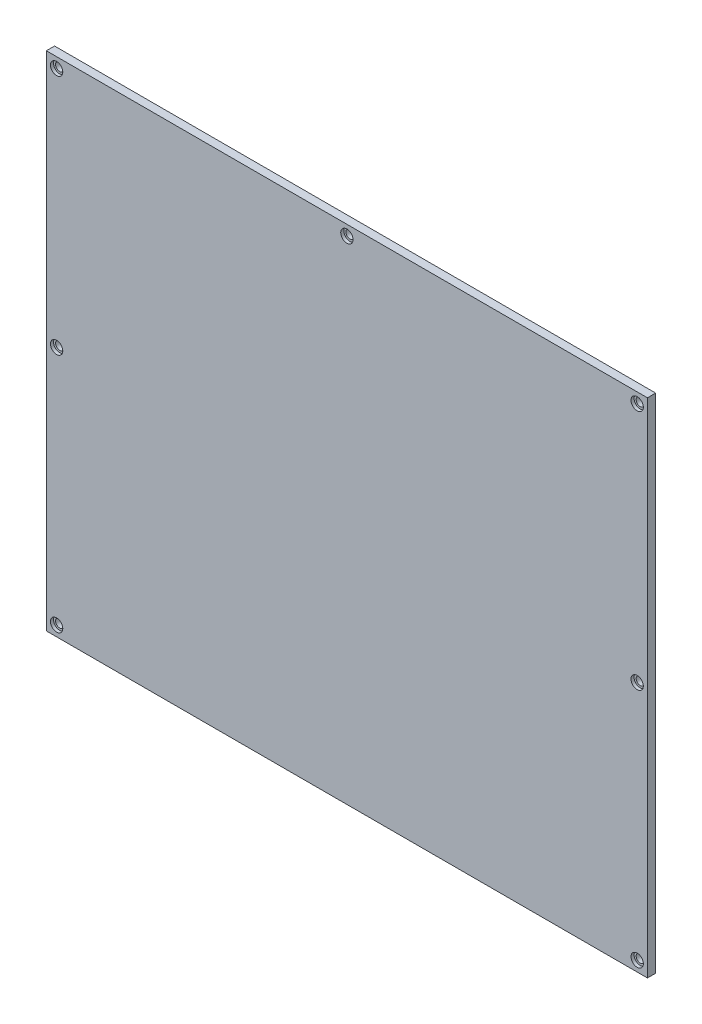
SolidWorks part; units mm, degrees
ref_plane "Front Plane" through (0, 0, 0) normal (0, 0, 1) x (1, 0, 0)
ref_plane "Top Plane" through (0, 0, 0) normal (0, 1, 0) x (1, 0, 0)
ref_plane "Right Plane" through (0, 0, 0) normal (1, 0, 0) x (0, 0, -1)
sketch "Sketch1" plane through (0, 0, 0) normal (0, 0, 1) x (1, 0, 0)
  line L1 (0, 0) -> (585, 0)
  line L2 (0, 0) -> (0, 489)
  line L3 (0, 489) -> (585, 489)
  line L4 (585, 0) -> (585, 489)
extrude "Boss-Extrude1" add sketch "Sketch1" along normal blind 8
sketch "Sketch2" plane through (0, 0, 8) normal (0, 0, 1) x (1, 0, 0)
  circle A0 centre (10, 479) radius 4
  circle A1 centre (10, 10) radius 4
  circle A2 centre (10, 244) radius 4
  circle A3 centre (292.5, 479) radius 4
  circle A4 centre (575, 479) radius 4
  circle A5 centre (575, 244) radius 4
  circle A6 centre (575, 10) radius 4
extrude "Cut-Extrude1" cut sketch "Sketch2" against normal blind 8
sketch "Sketch3" plane through (0, 0, 8) normal (0, 0, 1) x (1, 0, 0)
  circle A0 centre (10, 479) radius 6
  circle A1 centre (292.5, 479) radius 6
  circle A3 centre (575, 244) radius 6
  circle A4 centre (575, 479) radius 6
  circle A5 centre (10, 244) radius 6
  circle A6 centre (10, 10) radius 6
  circle A7 centre (575, 10) radius 6
extrude "Cut-Extrude2" cut sketch "Sketch3" against normal blind 3
